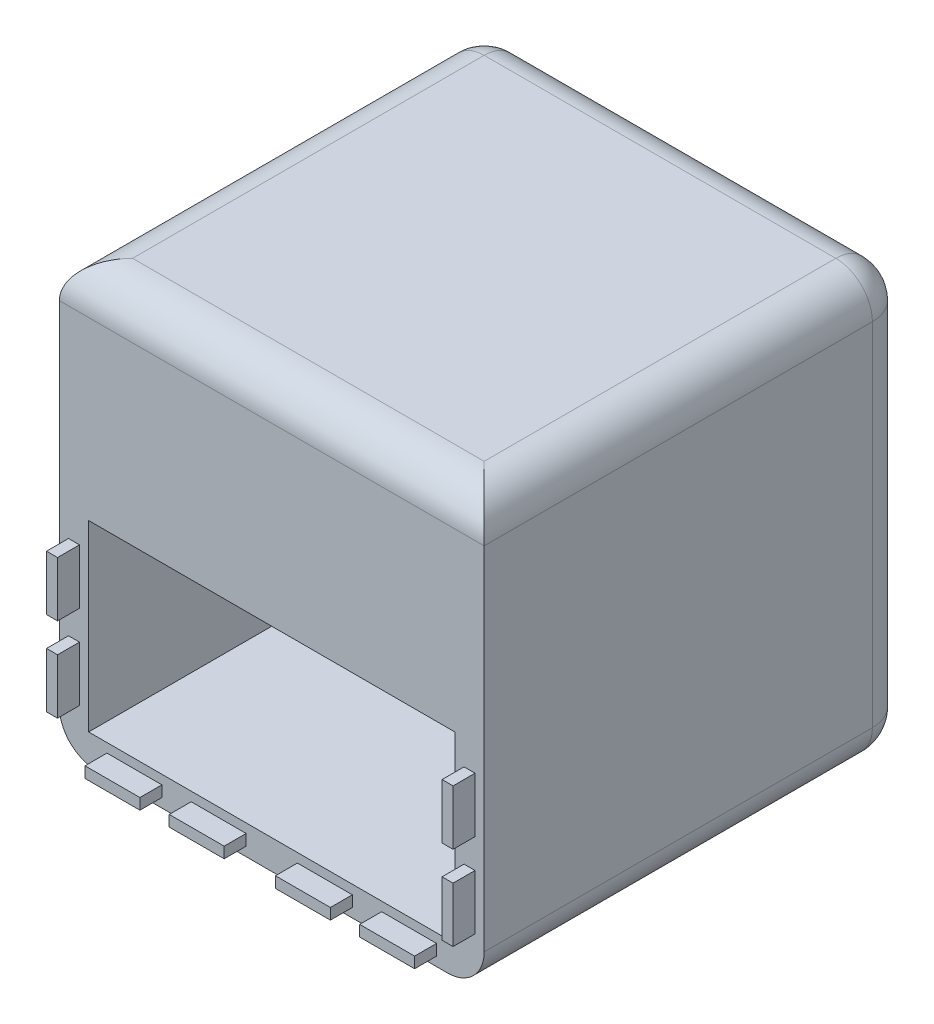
SolidWorks part; units mm, degrees
ref_plane "Alzado" through (0, 0, 0) normal (0, 0, 1) x (1, 0, 0)
ref_plane "Planta" through (0, 0, 0) normal (0, 1, 0) x (1, 0, 0)
ref_plane "Vista lateral" through (0, 0, 0) normal (1, 0, 0) x (0, 0, -1)
sketch "Croquis1" plane through (0, 0, 0) normal (0, 0, 1) x (1, 0, 0)
  line L1 (0, 0) -> (116, 0)
  line L2 (0, 0) -> (0, 116)
  line L3 (0, 116) -> (116, 116)
  line L4 (116, 0) -> (116, 116)
  dimension "D1" = 116
  dimension "D2" = 116
extrude "Saliente-Extruir1" add sketch "Croquis1" along normal blind 116
sketch "Croquis2" plane through (0, 116, 0) normal (0, 1, 0) x (1, 0, 0)
  line L0 (0, -116) -> (0, 0) construction
  line L1 (8, -8) -> (108, -8)
  line L2 (8, -8) -> (8, -108)
  line L3 (8, -108) -> (108, -108)
  line L4 (108, -8) -> (108, -108)
  line L5 (116, -116) -> (116, 0) construction
  line L6 (116, 0) -> (0, 0) construction
  line L7 (116, -116) -> (0, -116) construction
  dimension "D1" = 8
  dimension "D2" = 8
  dimension "D3" = 8
  dimension "D4" = 8
extrude "Cortar-Extruir1" cut sketch "Croquis2" against normal blind 108
sketch "Croquis3" plane through (0, 116, 0) normal (0, 1, 0) x (1, 0, 0)
  line L0 (108, -8) -> (8, -8) construction
  line L1 (8, -8) -> (108, -8)
  line L2 (8, -8) -> (8, -108)
  line L3 (8, -108) -> (108, -108)
  line L4 (108, -8) -> (108, -108)
  line L5 (108, -108) -> (108, -8) construction
  line L6 (8, -108) -> (108, -108) construction
  line L7 (8, -8) -> (8, -108) construction
extrude "Saliente-Extruir2" add sketch "Croquis3" against normal blind 8
sketch "Croquis4" plane through (0, 0, 116) normal (0, 0, 1) x (1, 0, 0)
  line L0 (0, 116) -> (0, 0) construction
  line L1 (8, 58) -> (108, 58)
  line L2 (8, 58) -> (8, 8)
  line L3 (8, 8) -> (108, 8)
  line L4 (108, 58) -> (108, 8)
  line L5 (116, 0) -> (116, 116) construction
  line L6 (0, 0) -> (116, 0) construction
  dimension "D1" = 8
  dimension "D2" = 8
  dimension "D3" = 8
  dimension "D4" = 50
extrude "Cortar-Extruir2" cut sketch "Croquis4" against normal blind 8
sketch "Croquis5" plane through (0, 0, 116) normal (0, 0, 1) x (1, 0, 0)
  line L0 (0, 0) -> (116, 0) construction
  line L1 (5.5, 13) -> (2.5, 13)
  line L2 (5.5, 13) -> (5.5, 28)
  line L3 (5.5, 28) -> (2.5, 28)
  line L4 (2.5, 13) -> (2.5, 28)
  line L5 (5.5, 36) -> (2.5, 36)
  line L6 (5.5, 36) -> (5.5, 51)
  line L7 (5.5, 51) -> (2.5, 51)
  line L8 (2.5, 36) -> (2.5, 51)
  line L9 (13, 5.5) -> (28, 5.5)
  line L10 (13, 5.5) -> (13, 2.5)
  line L11 (13, 2.5) -> (28, 2.5)
  line L12 (28, 5.5) -> (28, 2.5)
  line L13 (36, 5.5) -> (51, 5.5)
  line L14 (36, 5.5) -> (36, 2.5)
  line L15 (36, 2.5) -> (51, 2.5)
  line L16 (51, 5.5) -> (51, 2.5)
  line L17 (65, 5.5) -> (80, 5.5)
  line L18 (65, 5.5) -> (65, 2.5)
  line L19 (65, 2.5) -> (80, 2.5)
  line L20 (80, 5.5) -> (80, 2.5)
  line L21 (88, 5.5) -> (103, 5.5)
  line L22 (88, 5.5) -> (88, 2.5)
  line L23 (88, 2.5) -> (103, 2.5)
  line L24 (103, 5.5) -> (103, 2.5)
  line L25 (113.5, 13) -> (110.5, 13)
  line L26 (113.5, 13) -> (113.5, 28)
  line L27 (113.5, 28) -> (110.5, 28)
  line L28 (110.5, 13) -> (110.5, 28)
  line L29 (113.5, 36) -> (110.5, 36)
  line L30 (113.5, 36) -> (113.5, 51)
  line L31 (113.5, 51) -> (110.5, 51)
  line L32 (110.5, 36) -> (110.5, 51)
  line L33 (0, 116) -> (0, 0) construction
  line L34 (116, 0) -> (116, 116) construction
  point P39 (88, 4)
  dimension "D1" = 15
  dimension "D2" = 15
  dimension "D3" = 13
  dimension "D4" = 8
  dimension "D5" = 3
  dimension "D6" = 3
  dimension "D7" = 2.5
  dimension "D8" = 2.5
  dimension "D9" = 13
  dimension "D10" = 15
  dimension "D11" = 15
  dimension "D12" = 8
  dimension "D13" = 3
  dimension "D14" = 3
  dimension "D15" = 2.5
  dimension "D16" = 2.5
  dimension "D17" = 15
  dimension "D18" = 15
  dimension "D19" = 13
  dimension "D20" = 8
  dimension "D21" = 2.5
  dimension "D22" = 2.5
  dimension "D23" = 3
  dimension "D24" = 3
  dimension "D25" = 15
  dimension "D26" = 15
  dimension "D27" = 13
  dimension "D28" = 8
  dimension "D29" = 2.5
  dimension "D30" = 2.5
  dimension "D31" = 3
  dimension "D32" = 3
extrude "Saliente-Extruir3" add sketch "Croquis5" along normal blind 6
fillet "Redondeo1" radius 10 9 edges at (0, 0, 58) (116, 0, 58) (58, 0, 0) (116, 58, 0) (0, 58, 0) (58, 116, 0) (0, 116, 58) (116, 116, 58) (58, 116, 116)
